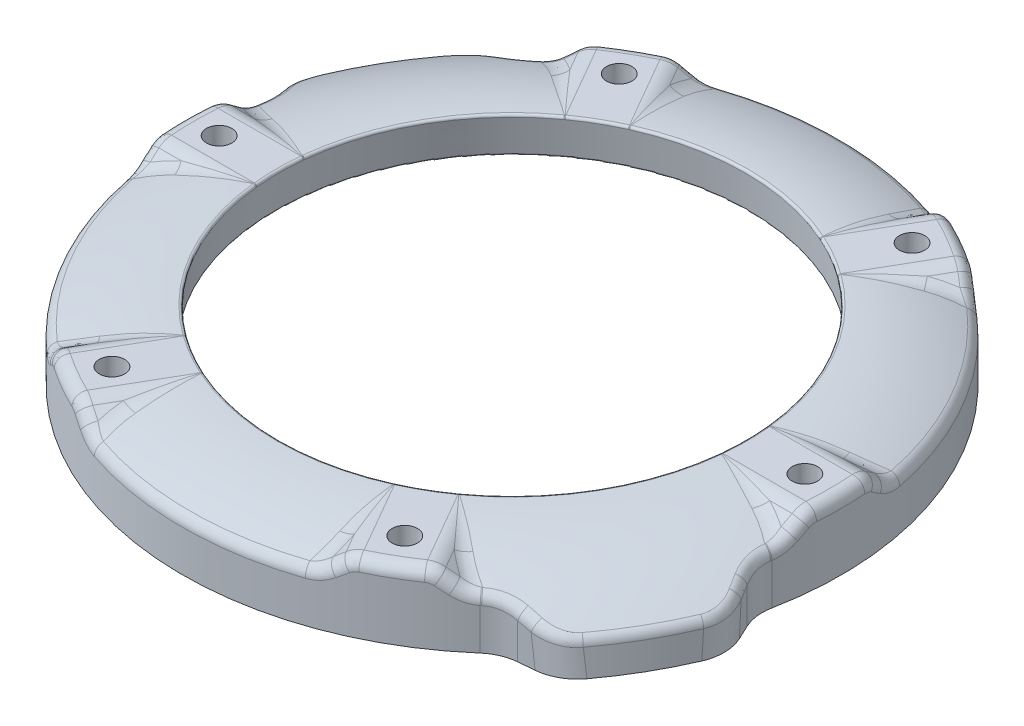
SolidWorks part; units mm, degrees
other "<WTE2-P-RETAINING-RING-R1>-<Fillet9>"
ref_plane "Front Plane" through (0, 0, 0) normal (0, 0, 1) x (1, 0, 0)
ref_plane "Top Plane" through (0, 0, 0) normal (0, 1, 0) x (1, 0, 0)
ref_plane "Right Plane" through (0, 0, 0) normal (1, 0, 0) x (0, 0, -1)
inserted part "WTE2-P-RETAINING-RING-R1"
